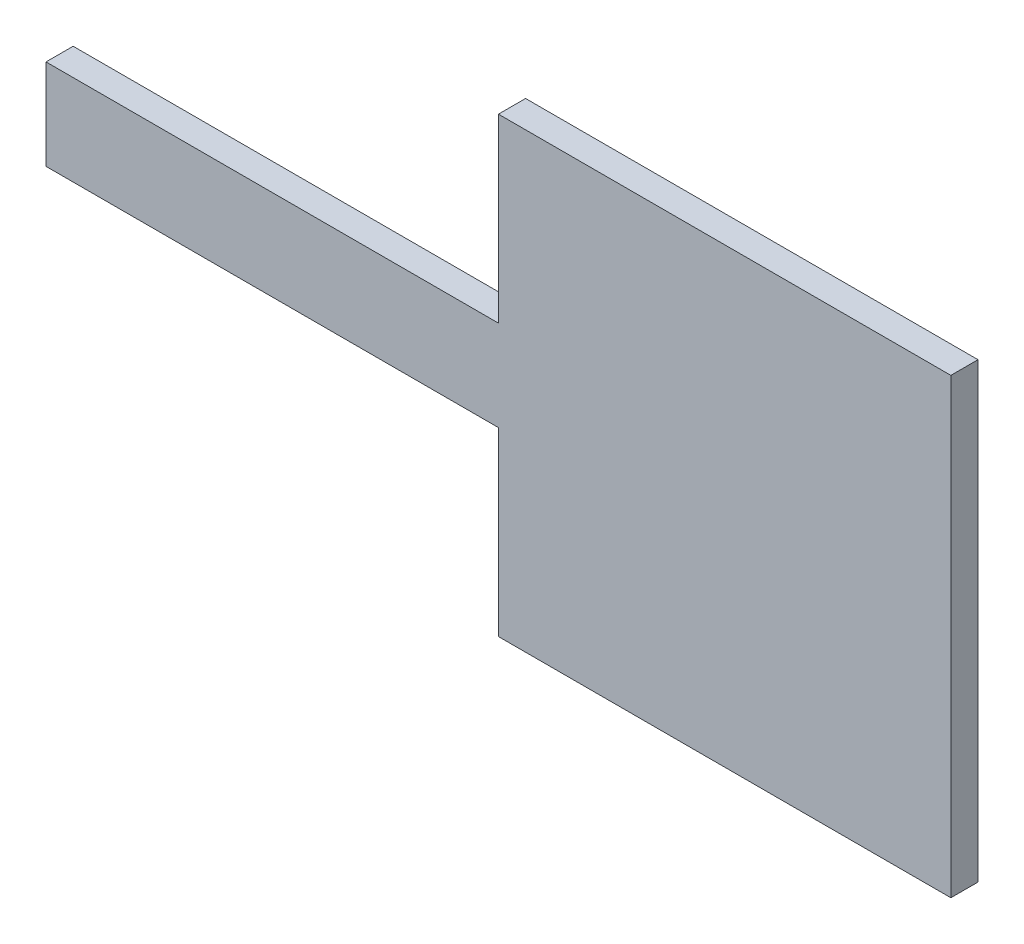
SolidWorks part; units mm, degrees
ref_plane "Alzado" through (0, 0, 0) normal (0, 0, 1) x (1, 0, 0)
ref_plane "Planta" through (0, 0, 0) normal (0, 1, 0) x (1, 0, 0)
ref_plane "Vista lateral" through (0, 0, 0) normal (1, 0, 0) x (0, 0, -1)
sketch "Croquis1" plane through (0, 0, 0) normal (0, 0, 1) x (1, 0, 0)
  line L22 (-25, 5) -> (-75, 5)
  line L37 (25, -25) -> (-25, -25)
  line L38 (25, -25) -> (25, 25)
  line L39 (25, 25) -> (-25, 25)
  line L40 (-25, -25) -> (-25, -5)
  line L41 (25, -25) -> (-25, 25) construction
  line L42 (25, 25) -> (-25, -25) construction
  line L43 (-75, 5) -> (-75, -5)
  line L44 (-75, -5) -> (-25, -5)
  line L45 (-25, 5) -> (-25, 25)
  point P0 (0, 0)
  point P9 (-75, 0)
  dimension "D1" = 10
  dimension "D2" = 50
  dimension "D3" = 50
  dimension "D4" = 50
extrude "Saliente-Extruir1" add sketch "Croquis1" along normal blind 3
